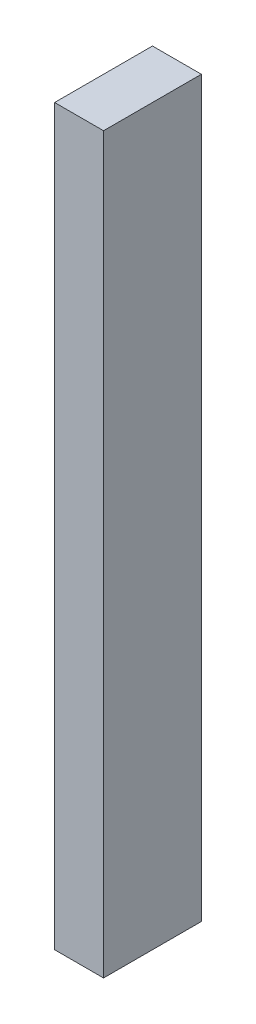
SolidWorks part; units mm, degrees
ref_plane "Plane1" through (0, 0, 0) normal (0, 0, 1) x (1, 0, 0)
ref_plane "Plane2" through (0, 0, 0) normal (0, 1, 0) x (1, 0, 0)
ref_plane "Plane3" through (0, 0, 0) normal (1, 0, 0) x (0, 0, -1)
sketch "Sketch1" plane through (0, 0, 0) normal (0, 0, 1) x (1, 0, 0)
  line L1 (0, 150) -> (10, 150)
  line L2 (0, 150) -> (0, 0)
  line L3 (0, 0) -> (10, 0)
  line L4 (10, 150) -> (10, 0)
  dimension "D1" = 150
extrude "Base-Extrude" add sketch "Sketch1" along normal mid plane 20
